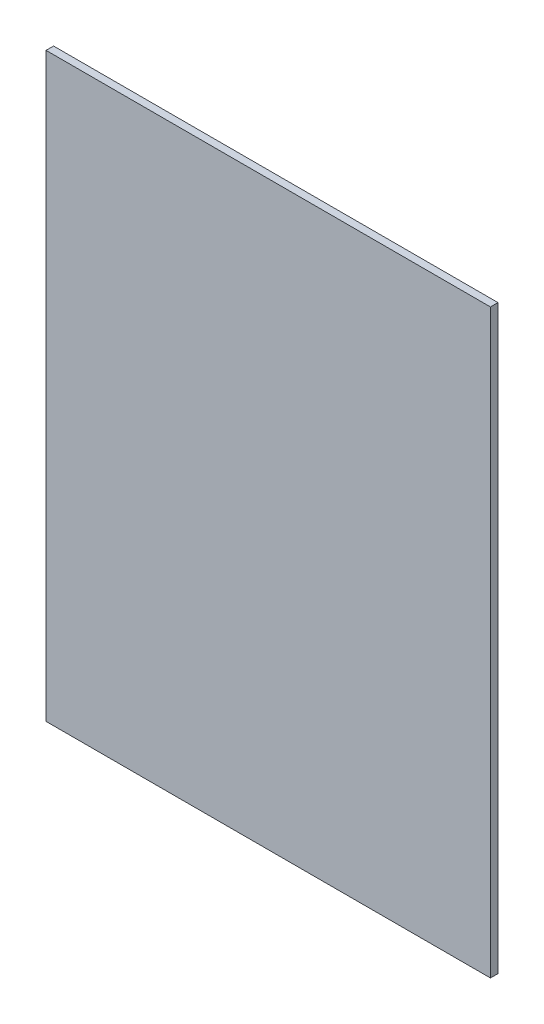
SolidWorks part; units mm, degrees
ref_plane "Front Plane" through (0, 0, 0) normal (0, 0, 1) x (1, 0, 0)
ref_plane "Top Plane" through (0, 0, 0) normal (0, 1, 0) x (1, 0, 0)
ref_plane "Right Plane" through (0, 0, 0) normal (1, 0, 0) x (0, 0, -1)
sketch "Sketch1" plane through (0, 0, 0) normal (0, 0, 1) x (1, 0, 0)
  line L1 (-82.55, 107.95) -> (82.55, 107.95)
  line L2 (-82.55, 107.95) -> (-82.55, -107.95)
  line L3 (-82.55, -107.95) -> (82.55, -107.95)
  line L4 (82.55, 107.95) -> (82.55, -107.95)
  line L5 (-82.55, 107.95) -> (82.55, -107.95) construction
  line L6 (-82.55, -107.95) -> (82.55, 107.95) construction
  point P0 (0, 0)
  dimension "D1" = 165.1
  dimension "D2" = 215.9
extrude "Boss-Extrude1" add sketch "Sketch1" along normal blind 2.794
equation "\"thickness_acrylic0.1\"=0.1in"
equation "\"motor offset\"=6mm"
equation "\"thickness0.25\"=0.225in"
equation "\"thickness0.125\"=0.122in"
